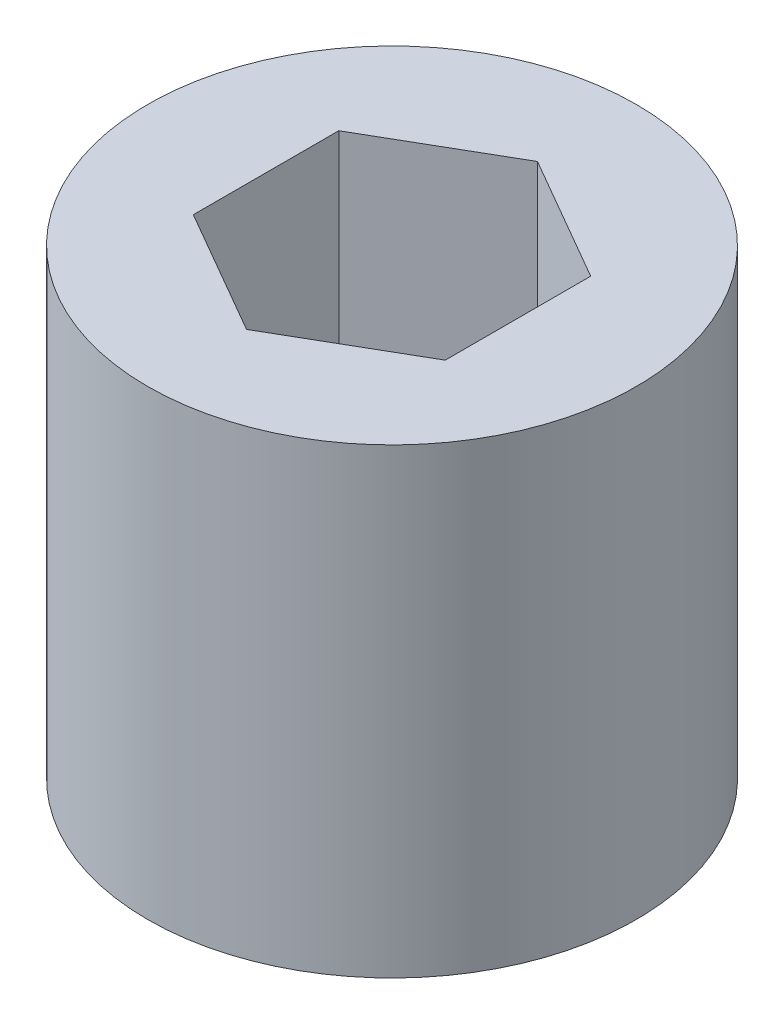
SolidWorks part; units mm, degrees
ref_plane "Front Plane" through (0, 0, 0) normal (0, 0, 1) x (1, 0, 0)
ref_plane "Top Plane" through (0, 0, 0) normal (0, 1, 0) x (1, 0, 0)
ref_plane "Right Plane" through (0, 0, 0) normal (1, 0, 0) x (0, 0, -1)
sketch "Sketch1" plane through (0, 0, 0) normal (0, 1, 0) x (1, 0, 0)
  line L1 (-6.5484, -3.7807) -> (0, -7.5615)
  line L2 (0, -7.5615) -> (6.5484, -3.7807)
  line L3 (6.5484, -3.7807) -> (6.5484, 3.7807)
  line L4 (6.5484, 3.7807) -> (0, 7.5615)
  line L5 (0, 7.5615) -> (-6.5484, 3.7807)
  line L6 (-6.5484, 3.7807) -> (-6.5484, -3.7807)
  circle A0 centre (0, 0) radius 12.7
  circle A1 centre (0, 0) radius 6.5484 construction
  dimension "D2" = 25.4
  dimension "D1" = 13.0969
extrude "Boss-Extrude1" add sketch "Sketch1" along normal blind 24
